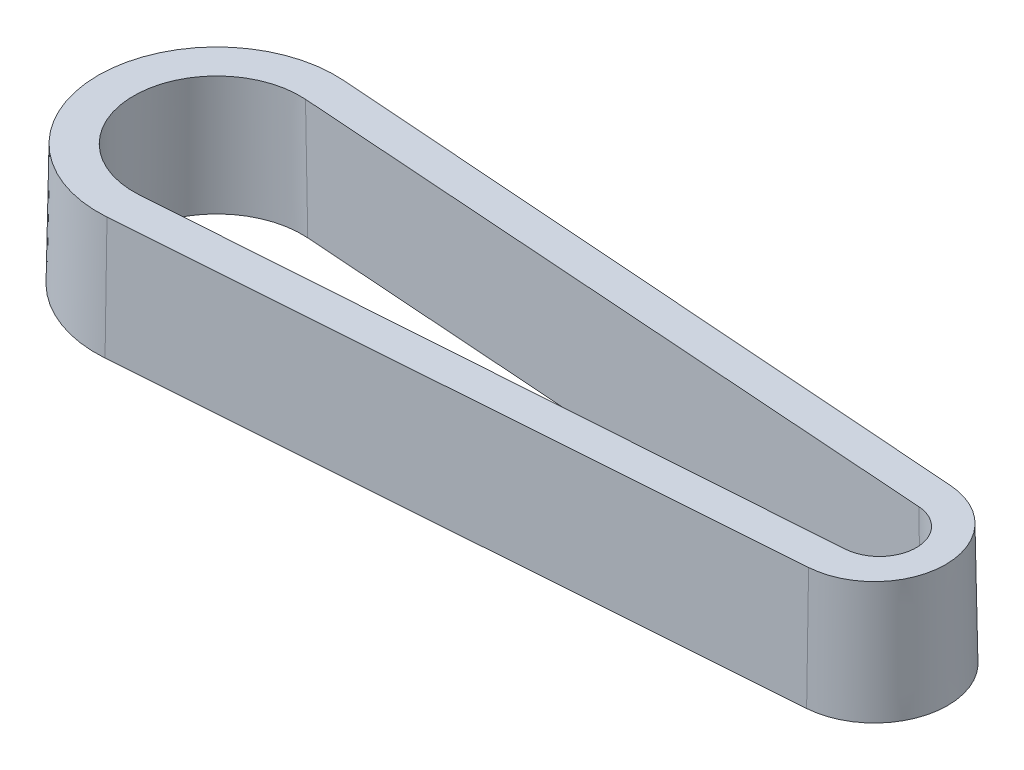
SolidWorks part; units mm, degrees
ref_plane "Front Plane" through (0, 0, 0) normal (0, 0, 1) x (1, 0, 0)
ref_plane "Top Plane" through (0, 0, 0) normal (0, 1, 0) x (1, 0, 0)
ref_plane "Right Plane" through (0, 0, 0) normal (1, 0, 0) x (0, 0, -1)
sketch "Sketch1" plane through (0, 0, 0) normal (0, 1, 0) x (1, 0, 0)
  line L0 (0, 0) -> (139.1765, 0) construction
  line L1 (0.5621, 8.0322) -> (62.8427, 3.674)
  line L2 (0.5621, -8.0322) -> (62.8427, -3.674)
  line L3 (0.8231, 11.3749) -> (62.6152, 6.9034)
  line L4 (0.8231, -11.3749) -> (62.6152, -6.9034)
  arc A0 (0.5621, 8.0322) -> (0.5621, -8.0322) centre (0, 0) ccw
  arc A1 (62.8427, -3.674) -> (62.8427, 3.674) centre (62.5856, 0) ccw
  arc A2 (0.8231, 11.3749) -> (0.8231, -11.3749) centre (0, 0) ccw
  arc A3 (62.6152, -6.9034) -> (62.6152, 6.9034) centre (62.1157, 0) ccw
  dimension "D1" = 16.1036
  dimension "D2" = 7.366
  dimension "D3" = 74.3204
  dimension "D4" = 11.4046
  dimension "D5" = 6.9215
  dimension "D6" = 80.4418
extrude "Boss-Extrude1" add sketch "Sketch1" along normal blind 11.43
draft "Draft1" type of draft neutral plane draft angle 1 faces to draft 4 parameters "D1"=1
draft "Draft4" type of draft neutral plane draft angle 1 faces to draft 4 parameters "D1"=1
